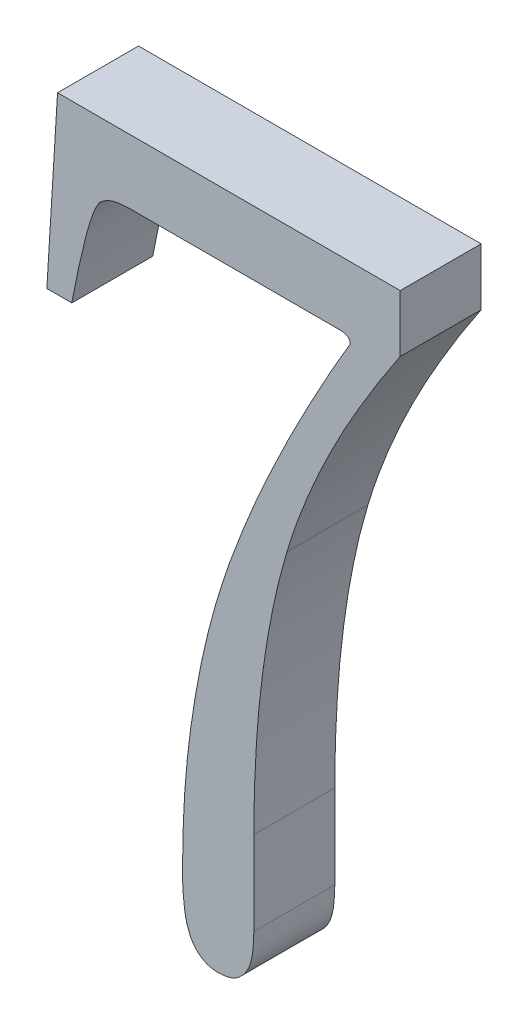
SolidWorks part; units mm, degrees
ref_plane "前基準面" through (0, 0, 0) normal (0, 0, 1) x (1, 0, 0)
ref_plane "上基準面" through (0, 0, 0) normal (0, 1, 0) x (1, 0, 0)
ref_plane "右基準面" through (0, 0, 0) normal (1, 0, 0) x (0, 0, -1)
sketch "草圖1" plane through (0, 0, 0) normal (0, 0, 1) x (1, 0, 0)
  text T0 "7" font "標楷體" height 25
extrude "填料-伸長1" add sketch "草圖1" along normal blind 3
